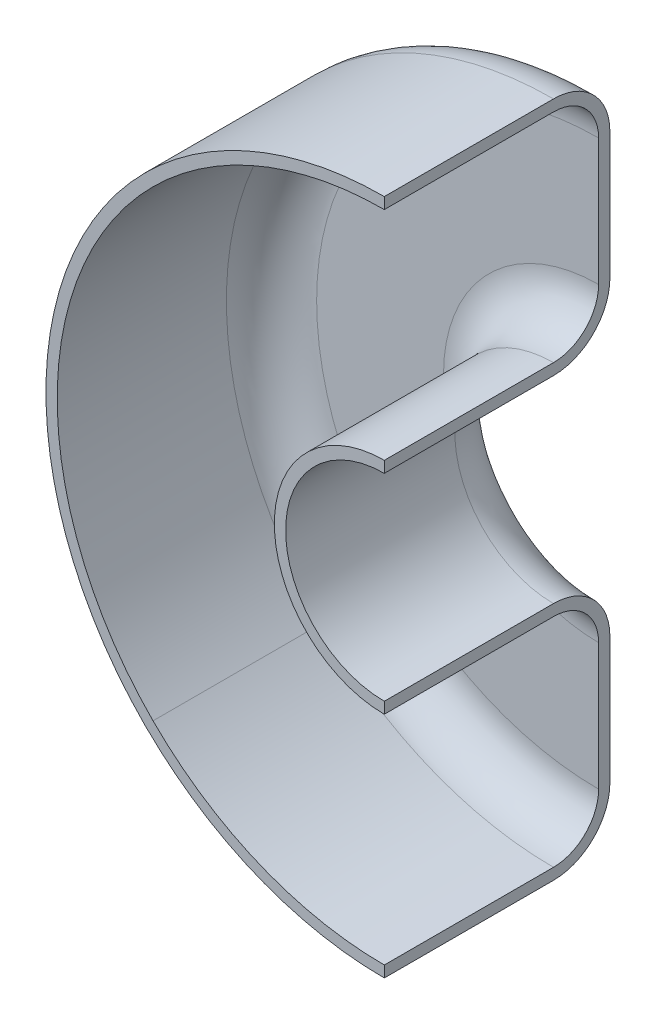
SolidWorks part; units mm, degrees
ref_plane "Front Plane" through (0, 0, 0) normal (0, 0, 1) x (1, 0, 0)
ref_plane "Top Plane" through (0, 0, 0) normal (0, 1, 0) x (1, 0, 0)
ref_plane "Right Plane" through (0, 0, 0) normal (1, 0, 0) x (0, 0, -1)
sketch "Sketch1" plane through (0, 0, 0) normal (0, 0, 1) x (1, 0, 0)
  circle A3 centre (0, 0) radius 60
  dimension "D1" = 120
extrude "Extrude1" add sketch "Sketch1" along normal blind 40
sketch "Sketch2" plane through (0, 0, 40) normal (0, 0, 1) x (1, 0, 0)
  circle A0 centre (0, 0) radius 17.5
  dimension "D1" = 35
extrude "Cut-Extrude1" cut sketch "Sketch2" against normal through all
fillet "Fillet1" radius 10 2 edges at (60, 0, 0) (17.5, 0, 0)
shell "Shell1" thickness 2
ref_plane "Plane1" through (0, 0, 0) normal (0.7071, 0.7071, 0) x (-0.7071, 0.7071, 0)
ref_plane "Plane2" through (0, 0, 0) normal (0.7071, -0.7071, 0) x (0, 0, -1)
sketch "Sketch3" plane through (0, 0, 0) normal (0.7071, 0.7071, 0) x (-0.7071, 0.7071, 0)
  line L0 (0, 40) -> (0, 0)
  line L1 (17.5, 40) -> (-17.5, 40) construction
  line L2 (0, 55.4254) -> (0, -55.4254) construction
  line L3 (-50, 0) -> (50, 0) construction
sketch "Sketch4" plane through (0, 0, 0) normal (0.7071, -0.7071, 0) x (0, 0, -1)
  line L0 (-40.6425, 0) -> (0, 0)
  line L1 (-40, 0) -> (-10, 0) construction
sketch "Sketch5" plane through (0, 0, 0) normal (0, 1, 0) x (1, 0, 0)
  line L0 (0, 0) -> (0, -40)
  line L1 (-42.4264, -40) -> (42.4264, -40) construction
extrude "symmetry" cut sketch "Sketch5" against normal through all and the other way through all
surface "Surface-MidSurface1" parameters "D0"=50000, "D1"=50000, "D4"=50000, "D2"=50000, "D3"=50000, "D5"=50000, "D6"=50000
